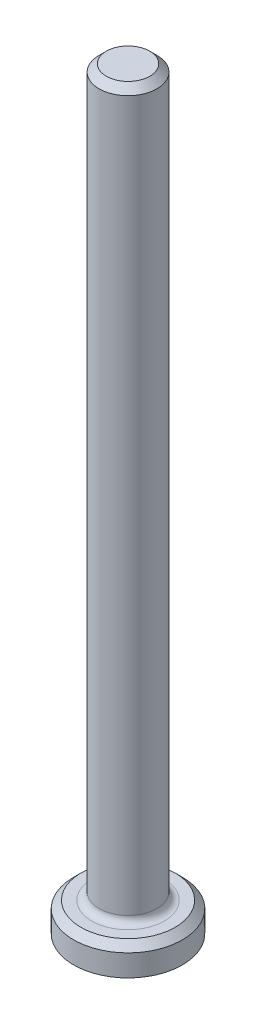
SolidWorks part; units mm, degrees
ref_plane "Front Plane" through (0, 0, 0) normal (0, 0, 1) x (1, 0, 0)
ref_plane "Top Plane" through (0, 0, 0) normal (0, 1, 0) x (1, 0, 0)
ref_plane "Right Plane" through (0, 0, 0) normal (1, 0, 0) x (0, 0, -1)
sketch "Sketch1" plane through (0, 0, 0) normal (0, 1, 0) x (1, 0, 0)
  circle A0 centre (0, 0) radius 101.6
  dimension "D1" = 203.2
extrude "Boss-Extrude1" add sketch "Sketch1" along normal mid plane 2540 contours A0
sketch "Sketch2" plane through (0, -1270, 0) normal (0, -1, 0) x (1, 0, 0)
  circle A0 centre (0, 0) radius 190.5
  dimension "D1" = 381
extrude "Boss-Extrude2" add sketch "Sketch2" along normal blind 101.6
chamfer "Chamfer1" distance 25.4 angle 45 1 edges at (0, -1270, -190.5)
chamfer "Chamfer2" distance 25.4 angle 45 1 edges at (0, 1270, 101.6)
fillet "Fillet1" radius 25.4 1 edges at (0, -1270, 101.6)
